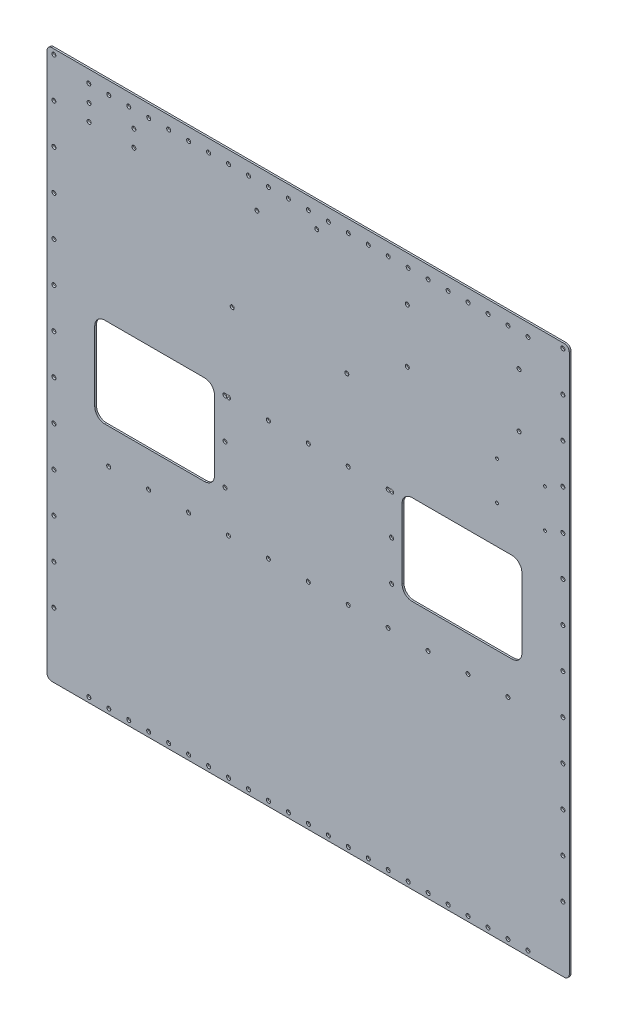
SolidWorks part; units mm, degrees
ref_plane "Front Plane" through (0, 0, 0) normal (0, 0, 1) x (1, 0, 0)
ref_plane "Top Plane" through (0, 0, 0) normal (0, 1, 0) x (1, 0, 0)
ref_plane "Right Plane" through (0, 0, 0) normal (1, 0, 0) x (0, 0, -1)
sketch "Sketch1" plane through (0, 0, 0) normal (0, 0, 1) x (1, 0, 0)
  line L1 (0, 0) -> (664.718, 0)
  line L2 (0, 0) -> (0, -698.5)
  line L3 (0, -698.5) -> (664.718, -698.5)
  line L4 (664.718, 0) -> (664.718, -698.5)
  dimension "D1" = 698.5
  dimension "D2" = 664.718
base flange "Base-Flange1" sketch "Sketch1" thickness 2.286 reverse thickness direction no parameters "D1"=2.286
fillet "Fillet1" radius 6.35 1 edges at (664.718, 0, -1.143)
fillet "Fillet2" radius 6.35 3 edges at (664.718, -698.5, -1.143) (0, -698.5, -1.143) (0, 0, -1.143)
hole_wizard "Hole1" positions "Sketch6" profile "Sketch7" legacy
sketch "Sketch6" plane through (0, 0, 0) normal (0, 0, 1) x (1, 0, 0)
  line L0 (658.368, 0) -> (6.35, 0) construction
  line L1 (0, -6.35) -> (0, -692.15) construction
  point P0 (8.89, -6.35)
  dimension "D1" = 6.35
  dimension "D2" = 8.89
sketch "Sketch7" plane through (8.89, -6.35, 0) normal (1, 0, 0) x (0, -1, 0)
  line L0 (0, 0) -> (0, 2.287)
  line L1 (0, 2.287) -> (2.54, 2.287)
  line L2 (2.54, 2.287) -> (2.54, 0)
  line L3 (2.54, 0) -> (0, 0)
  line L4 (0, 110) -> (0, -10) construction
  dimension "Diameter" = 5.08
  dimension "Depth" = 2.287
pattern_linear "LPattern1" count 13 spacing 50.8 along (0, -1, 0) of "Hole1"
pattern_linear "LPattern2" count 2 spacing 647.7 along (1, 0, 0) of "LPattern1", "Hole1"
hole_wizard "Hole2" positions "Sketch8" profile "Sketch9" legacy
sketch "Sketch8" plane through (0, 0, 0) normal (0, 0, 1) x (1, 0, 0)
  line L0 (6.35, -698.5) -> (658.368, -698.5) construction
  circle A2 centre (656.59, -615.95) radius 2.54 construction
  point P0 (612.14, -692.15)
  dimension "D1" = 6.35
  dimension "D2" = 44.45
sketch "Sketch9" plane through (612.14, -692.15, 0) normal (1, 0, 0) x (0, -1, 0)
  line L0 (0, 0) -> (0, 93.98)
  line L1 (0, 93.98) -> (2.54, 93.98)
  line L2 (2.54, 93.98) -> (2.54, 0)
  line L3 (2.54, 0) -> (0, 0)
  line L4 (0, 110) -> (0, -10) construction
  dimension "Diameter" = 5.08
  dimension "Depth" = 93.98
pattern_linear "LPattern3" count 23 spacing 25.4 along (-1, 0, 0) count 2 spacing 676.275 along (0, 1, 0) of "Hole2"
hole_wizard "Hole3" positions "Sketch10" profile "Sketch11" legacy
sketch "Sketch10" plane through (0, 0, -2.286) normal (0, 0, -1) x (-1, 0, 0)
  line L1 (-664.718, -692.15) -> (-664.718, -6.35) construction
  point P0 (-586.613, -425.45)
  point P8 (-664.718, -349.25)
  dimension "D1" = 76.2
  dimension "D2" = 78.105
sketch "Sketch11" plane through (586.613, -425.45, -2.286) normal (1, 0, 0) x (0, 1, 0)
  line L0 (0, 0) -> (0, 93.98)
  line L1 (0, 93.98) -> (2.54, 93.98)
  line L2 (2.54, 93.98) -> (2.54, 0)
  line L3 (2.54, 0) -> (0, 0)
  line L4 (0, 110) -> (0, -10) construction
  dimension "Diameter" = 5.08
  dimension "Depth" = 93.98
pattern_linear "LPattern4" count 2 spacing 152.4 along (0, 1, 0) count 11 spacing 50.8 along (-1, 0, 0) of "Hole3"
hole_wizard "Hole4" positions "Sketch12" profile "Sketch13" legacy
sketch "Sketch12" plane through (0, 0, 0) normal (0, 0, 1) x (1, 0, 0)
  point P0 (438.658, -273.05)
  point P3 (438.658, -323.85)
  point P6 (438.658, -374.65)
  point P9 (226.568, -374.65)
  point P12 (226.568, -323.85)
  point P15 (226.568, -273.05)
sketch "Sketch13" plane through (438.658, -273.05, 0) normal (1, 0, 0) x (0, -1, 0)
  line L0 (0, 0) -> (0, 93.98)
  line L1 (0, 93.98) -> (2.54, 93.98)
  line L2 (2.54, 93.98) -> (2.54, 0)
  line L3 (2.54, 0) -> (0, 0)
  line L4 (0, 110) -> (0, -10) construction
  dimension "Diameter" = 5.08
  dimension "Depth" = 93.98
sketch "Sketch14" plane through (0, 0, 0) normal (0, 0, 1) x (1, 0, 0)
  line L0 (60.833, -368.3) -> (60.833, -279.4) construction
  line L1 (73.533, -381) -> (200.533, -381)
  line L2 (60.833, -368.3) -> (60.833, -279.4)
  line L3 (73.533, -266.7) -> (200.533, -266.7)
  line L4 (213.233, -368.3) -> (213.233, -279.4)
  line L5 (73.533, -266.7) -> (200.533, -266.7) construction
  line L7 (591.693, -381) -> (464.693, -381)
  line L8 (604.393, -368.3) -> (604.393, -279.4)
  line L9 (591.693, -266.7) -> (464.693, -266.7)
  line L10 (451.993, -368.3) -> (451.993, -279.4)
  line L11 (464.693, -266.7) -> (591.693, -266.7) construction
  line L12 (604.393, -279.4) -> (604.393, -368.3) construction
  arc A0 (60.833, -368.3) -> (73.533, -381) centre (73.533, -368.3) ccw
  arc A1 (200.533, -381) -> (213.233, -368.3) centre (200.533, -368.3) ccw
  arc A2 (213.233, -279.4) -> (200.533, -266.7) centre (200.533, -279.4) ccw
  arc A3 (60.833, -279.4) -> (73.533, -266.7) centre (73.533, -279.4) cw
  arc A4 (451.993, -279.4) -> (464.693, -266.7) centre (464.693, -279.4) cw
  arc A5 (451.993, -368.3) -> (464.693, -381) centre (464.693, -368.3) ccw
  arc A6 (591.693, -381) -> (604.393, -368.3) centre (591.693, -368.3) ccw
  arc A7 (604.393, -279.4) -> (591.693, -266.7) centre (591.693, -279.4) ccw
  point P10 (60.833, -381)
  point P15 (213.233, -266.7)
  point P18 (60.833, -266.7)
  point P29 (451.993, -266.7)
  point P32 (451.993, -381)
  point P37 (604.393, -266.7)
  dimension "D5" = 12.7
  dimension "D10" = 12.7
  dimension "D1" = 114.3
  dimension "D2" = 152.4
  dimension "D3" = 0
  dimension "D4" = 0
  dimension "D6" = 152.4
  dimension "D7" = 114.3
  dimension "D8" = 0
  dimension "D9" = 152.4
extrude "Cut-Extrude1" cut sketch "Sketch14" against normal blind 2.54
hole_wizard "Hole5" positions "Sketch15" profile "Sketch16" legacy
sketch "Sketch15" plane through (0, 0, 0) normal (0, 0, 1) x (1, 0, 0)
  point P0 (110.6249, -58.1401)
  point P2 (110.6249, -37.1401)
  point P4 (53.6249, -37.1401)
  point P6 (53.6249, -58.1401)
  point P8 (267.1758, -49.2817)
  point P10 (343.3758, -31.5017)
  point P12 (458.5983, -56.9606)
  point P14 (600.8383, -56.9606)
  point P16 (600.8383, -125.5406)
  point P18 (458.5983, -125.5406)
  point P22 (235.7806, -171.2637)
  point P24 (381.5766, -171.2637)
sketch "Sketch16" plane through (110.6249, -58.1401, 0) normal (1, 0, 0) x (0, -1, 0)
  line L0 (0, 0) -> (0, 93.98)
  line L1 (0, 93.98) -> (2.54, 93.98)
  line L2 (2.54, 93.98) -> (2.54, 0)
  line L3 (2.54, 0) -> (0, 0)
  line L4 (0, 110) -> (0, -10) construction
  dimension "Diameter" = 5.08
  dimension "Depth" = 93.98
hole_wizard "Hole7" positions "Sketch19" profile "Sketch20" legacy
sketch "Sketch19" plane through (0, 0, 0) normal (0, 0, 1) x (1, 0, 0)
  point P0 (572.7665, -218.5127)
  point P2 (633.8027, -218.5127)
  point P4 (633.8027, -169.6685)
  point P6 (572.7665, -169.6685)
sketch "Sketch20" plane through (572.7665, -218.5127, 0) normal (1, 0, 0) x (0, -1, 0)
  line L0 (0, 0) -> (0, 2.286)
  line L1 (0, 2.286) -> (1.778, 2.286)
  line L2 (1.778, 2.286) -> (1.778, 0)
  line L3 (1.778, 0) -> (0, 0)
  line L4 (0, 110) -> (0, -10) construction
  dimension "Diameter" = 3.556
  dimension "Depth" = 2.286
sketch "Bend-Lines1" [suppressed] plane through (0, 0, 0) normal (0, 1, 0) x (1, 0, 0)
sketch "Bounding-Box1" [suppressed] plane through (0, 0, 0) normal (0, 1, 0) x (1, 0, 0)
sheet metal parameters "Sheet-Metal1" thickness 2.286 parameters "D1"=2.286
flat pattern "Flat-Pattern1"
sketch "Bend-Lines2" plane through (0, 0, 0) normal (0, 1, 0) x (1, 0, 0)
sketch3d "Bounding-Box2" [suppressed]
  line L0 (654.0499, -666.75, 0) -> (654.05, 0, 0) construction
  line L1 (0, -666.7499, 0) -> (0.0001, 0.0001, 0) construction
  line L2 (654.0499, -666.75, 0) -> (0, -666.7499, 0) construction
  line L3 (654.05, 0, 0) -> (0.0001, 0.0001, 0) construction
sheet metal parameters "Sheet-Metal2" thickness 2.286 parameters "D1"=2.286
flat pattern "Flat-Pattern1"
sketch "Bend-Lines2" plane through (0, 0, 0) normal (0, 1, 0) x (1, 0, 0)
sketch3d "Bounding-Box2" [suppressed]
  line L0 (0.0001, 0.0001, 0) -> (664.718, 0, 0) construction
  line L1 (0, -647.6999, 0) -> (664.7179, -647.7, 0) construction
  line L2 (0.0001, 0.0001, 0) -> (0, -647.6999, 0) construction
  line L3 (664.718, 0, 0) -> (664.7179, -647.7, 0) construction
sheet metal parameters "Sheet-Metal3" thickness 2.286 parameters "D1"=2.286
flat pattern "Flat-Pattern1"
sketch "Bend-Lines2" plane through (0, 0, 0) normal (0, 1, 0) x (1, 0, 0)
sketch3d "Bounding-Box2" [suppressed]
  line L0 (0.0001, 0.0001, 0) -> (664.718, 0, 0) construction
  line L1 (0, -647.6999, 0) -> (664.7179, -647.7, 0) construction
  line L2 (0.0001, 0.0001, 0) -> (0, -647.6999, 0) construction
  line L3 (664.718, 0, 0) -> (664.7179, -647.7, 0) construction
sheet metal parameters "Sheet-Metal4" thickness 2.286 parameters "D1"=2.286
flat pattern "Flat-Pattern1"
sketch "Bend-Lines2" plane through (0, 0, 0) normal (0, 1, 0) x (1, 0, 0)
sketch3d "Bounding-Box2" [suppressed]
  line L0 (0.0001, 0.0001, 0) -> (664.718, 0, 0) construction
  line L1 (0, -647.6999, 0) -> (664.7179, -647.7, 0) construction
  line L2 (0.0001, 0.0001, 0) -> (0, -647.6999, 0) construction
  line L3 (664.718, 0, 0) -> (664.7179, -647.7, 0) construction
sheet metal parameters "Sheet-Metal5" thickness 2.286 parameters "D1"=2.286
flat pattern "Flat-Pattern1"
sketch "Bend-Lines2" plane through (0, 0, 0) normal (0, 1, 0) x (1, 0, 0)
sketch3d "Bounding-Box2" [suppressed]
  line L0 (0.0001, 0.0001, 0) -> (664.718, 0, 0) construction
  line L1 (0, -647.6999, 0) -> (664.7179, -647.7, 0) construction
  line L2 (0.0001, 0.0001, 0) -> (0, -647.6999, 0) construction
  line L3 (664.718, 0, 0) -> (664.7179, -647.7, 0) construction
sheet metal parameters "Sheet-Metal6" thickness 2.286 parameters "D1"=2.286
flat pattern "Flat-Pattern1"
sketch "Bend-Lines2" plane through (0, 0, 0) normal (0, 1, 0) x (1, 0, 0)
sketch3d "Bounding-Box2" [suppressed]
  line L0 (0.0001, 0.0001, 0) -> (664.718, 0, 0) construction
  line L1 (0, -647.6999, 0) -> (664.7179, -647.7, 0) construction
  line L2 (0.0001, 0.0001, 0) -> (0, -647.6999, 0) construction
  line L3 (664.718, 0, 0) -> (664.7179, -647.7, 0) construction
sheet metal parameters "Sheet-Metal7" thickness 2.286 parameters "D1"=2.286
flat pattern "Flat-Pattern1"
sketch "Bend-Lines2" plane through (0, 0, 0) normal (0, 1, 0) x (1, 0, 0)
sketch3d "Bounding-Box2" [suppressed]
  line L0 (0.0001, 0.0001, 0) -> (664.718, 0, 0) construction
  line L1 (0, -647.6999, 0) -> (664.7179, -647.7, 0) construction
  line L2 (0.0001, 0.0001, 0) -> (0, -647.6999, 0) construction
  line L3 (664.718, 0, 0) -> (664.7179, -647.7, 0) construction
sheet metal parameters "Sheet-Metal8" thickness 2.286 parameters "D1"=2.286
flat pattern "Flat-Pattern1"
sketch "Bend-Lines2" plane through (0, 0, 0) normal (0, 1, 0) x (1, 0, 0)
sketch3d "Bounding-Box2" [suppressed]
  line L0 (0.0001, 0.0001, 0) -> (664.718, 0, 0) construction
  line L1 (0, -647.6999, 0) -> (664.7179, -647.7, 0) construction
  line L2 (0.0001, 0.0001, 0) -> (0, -647.6999, 0) construction
  line L3 (664.718, 0, 0) -> (664.7179, -647.7, 0) construction
sheet metal parameters "Sheet-Metal9" thickness 2.286 parameters "D1"=2.286
flat pattern "Flat-Pattern1"
sketch "Bend-Lines2" plane through (0, 0, 0) normal (0, 1, 0) x (1, 0, 0)
sketch3d "Bounding-Box2" [suppressed]
  line L0 (0.0001, 0.0001, 0) -> (664.718, 0, 0) construction
  line L1 (0, -647.6999, 0) -> (664.7179, -647.7, 0) construction
  line L2 (0.0001, 0.0001, 0) -> (0, -647.6999, 0) construction
  line L3 (664.718, 0, 0) -> (664.7179, -647.7, 0) construction
sheet metal parameters "Sheet-Metal10" thickness 2.286 parameters "D1"=2.286
flat pattern "Flat-Pattern1"
sketch "Bend-Lines2" plane through (0, 0, 0) normal (0, 1, 0) x (1, 0, 0)
sketch3d "Bounding-Box2" [suppressed]
  line L0 (0.0001, 0.0001, 0) -> (664.718, 0, 0) construction
  line L1 (0, -647.6999, 0) -> (664.7179, -647.7, 0) construction
  line L2 (0.0001, 0.0001, 0) -> (0, -647.6999, 0) construction
  line L3 (664.718, 0, 0) -> (664.7179, -647.7, 0) construction
sheet metal parameters "Sheet-Metal11" thickness 2.286 parameters "D1"=2.286
flat pattern "Flat-Pattern1"
sketch "Bend-Lines2" plane through (0, 0, 0) normal (0, 1, 0) x (1, 0, 0)
sketch3d "Bounding-Box2" [suppressed]
  line L0 (0.0001, 0.0001, 0) -> (664.718, 0, 0) construction
  line L1 (0, -647.6999, 0) -> (664.7179, -647.7, 0) construction
  line L2 (0.0001, 0.0001, 0) -> (0, -647.6999, 0) construction
  line L3 (664.718, 0, 0) -> (664.7179, -647.7, 0) construction
sheet metal parameters "Sheet-Metal13" thickness 2.286 parameters "D1"=2.286
flat pattern "Flat-Pattern1"
sketch "Bend-Lines2" plane through (0, 0, 0) normal (0, 1, 0) x (1, 0, 0)
sketch3d "Bounding-Box2" [suppressed]
  line L0 (664.7179, -698.5, 0) -> (664.718, 0, 0) construction
  line L1 (0, -698.4999, 0) -> (0.0001, 0.0001, 0) construction
  line L2 (664.7179, -698.5, 0) -> (0, -698.4999, 0) construction
  line L3 (664.718, 0, 0) -> (0.0001, 0.0001, 0) construction
